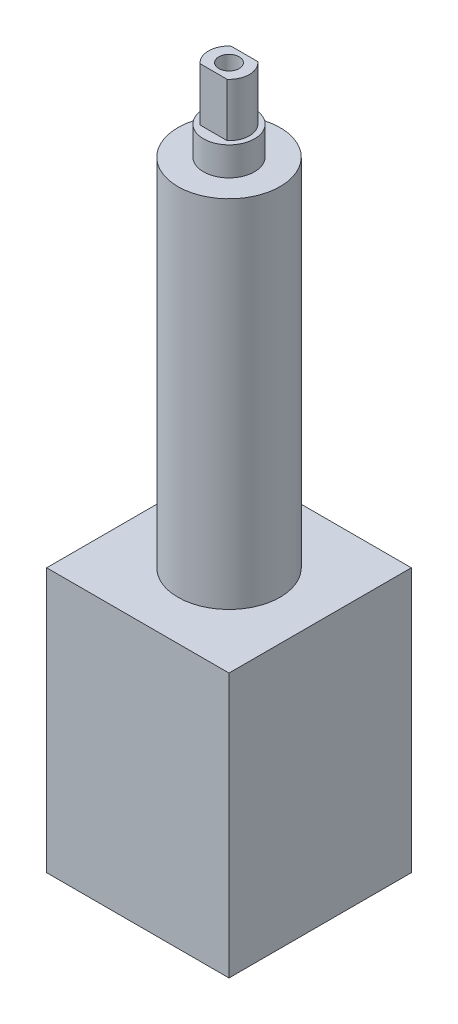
SolidWorks part; units mm, degrees
ref_plane "Front Plane" through (0, 0, 0) normal (0, 0, 1) x (1, 0, 0)
ref_plane "Top Plane" through (0, 0, 0) normal (0, 1, 0) x (1, 0, 0)
ref_plane "Right Plane" through (0, 0, 0) normal (1, 0, 0) x (0, 0, -1)
sketch "Sketch1" plane through (0, 0, 0) normal (0, 1, 0) x (1, 0, 0)
  line L1 (-28.321, 28.321) -> (28.321, 28.321)
  line L2 (-28.321, 28.321) -> (-28.321, -28.321)
  line L3 (-28.321, -28.321) -> (28.321, -28.321)
  line L4 (28.321, 28.321) -> (28.321, -28.321)
  dimension "D1" = 56.642
  dimension "D2" = 56.642
  dimension "D3" = 28.321
  dimension "D4" = 28.321
extrude "Extrude1" add sketch "Sketch1" along normal blind 82.042
sketch "Sketch2" plane through (0, 82.042, 0) normal (0, 1, 0) x (-1, 0, 0)
  circle A0 centre (0, 0) radius 15.875
  dimension "D1" = 31.75
extrude "Extrude2" add sketch "Sketch2" along normal blind 110.49
sketch "Sketch3" plane through (0, 192.532, 0) normal (0, 1, 0) x (-1, 0, 0)
  circle A0 centre (0, 0) radius 7.9375
  dimension "D1" = 15.875
extrude "Extrude3" add sketch "Sketch3" along normal blind 8.89
sketch "Sketch4" plane through (0, 201.422, 0) normal (0, 1, 0) x (-1, 0, 0)
  circle A0 centre (0, 0) radius 6.35
  dimension "D1" = 12.7
extrude "Extrude4" add sketch "Sketch4" along normal blind 16.51
hole_wizard "1/4-28 Tapped Hole1" positions "3DSketch1" profile "Sketch6" tap size "1/4-28" standard "Ansi Inch"
sketch3d "3DSketch1"
  line L0 (0, 217.932, 0) -> (0, 201.422, 0) construction
  point P0 (0, 217.932, 0)
sketch "Sketch6" plane through (0, 217.932, 0) normal (1, 0, 0) x (0, 0, 1)
  line L0 (0, 0) -> (0, 13.8174)
  line L1 (0, 13.8174) -> (2.7051, 12.192)
  line L2 (2.7051, 12.192) -> (2.7051, 9.652)
  line L3 (2.7051, 9.652) -> (3.175, 9.652)
  line L4 (3.175, 9.652) -> (3.175, 0)
  line L5 (3.175, 0) -> (0, 0)
  line L10 (0, 13.8174) -> (-2.7051, 12.192) construction
  line L11 (0, -6.35) -> (0, 107.95) construction
  dimension "Tap Drill Dia." = 5.4102
  dimension "Tap Drill Depth" = 12.192
  dimension "Thread Major Dia." = 6.35
  dimension "Thread Depth" = 9.652
  dimension "Drill Angle" = 118
sketch "Sketch7" plane through (0, 217.932, 0) normal (0, 1, 0) x (-1, 0, 0)
  line L0 (-13.335, -9.8425) -> (-13.335, 9.8425)
  line L1 (-8.255, -4.7625) -> (8.255, -4.7625)
  line L2 (-8.255, -4.7625) -> (-8.255, 4.7625)
  line L3 (-8.255, 4.7625) -> (8.255, 4.7625)
  line L4 (8.255, -4.7625) -> (8.255, 4.7625)
  line L5 (-13.335, 9.8425) -> (13.335, 9.8425)
  line L6 (13.335, -9.8425) -> (13.335, 9.8425)
  line L7 (-13.335, -9.8425) -> (13.335, -9.8425)
  dimension "D1" = 9.525
  dimension "D2" = 4.7625
  dimension "D3" = 8.255
  dimension "D4" = 16.51
  dimension "D5" = 5.08
extrude "Cut-Extrude2" cut sketch "Sketch7" against normal up to surface (16.51 mm away)
equation "\"D4@Sketch1\" = \"D1@Sketch1\"/2"
equation "\"D3@Sketch1\" = \"D2@Sketch1\"/2"
equation "\"D1@Sketch1\" = \"D2@Sketch1\""
equation "\"D2@Sketch7\" = \"D1@Sketch7\"/2"
equation "\"D3@Sketch7\" = \"D4@Sketch7\"/2"
